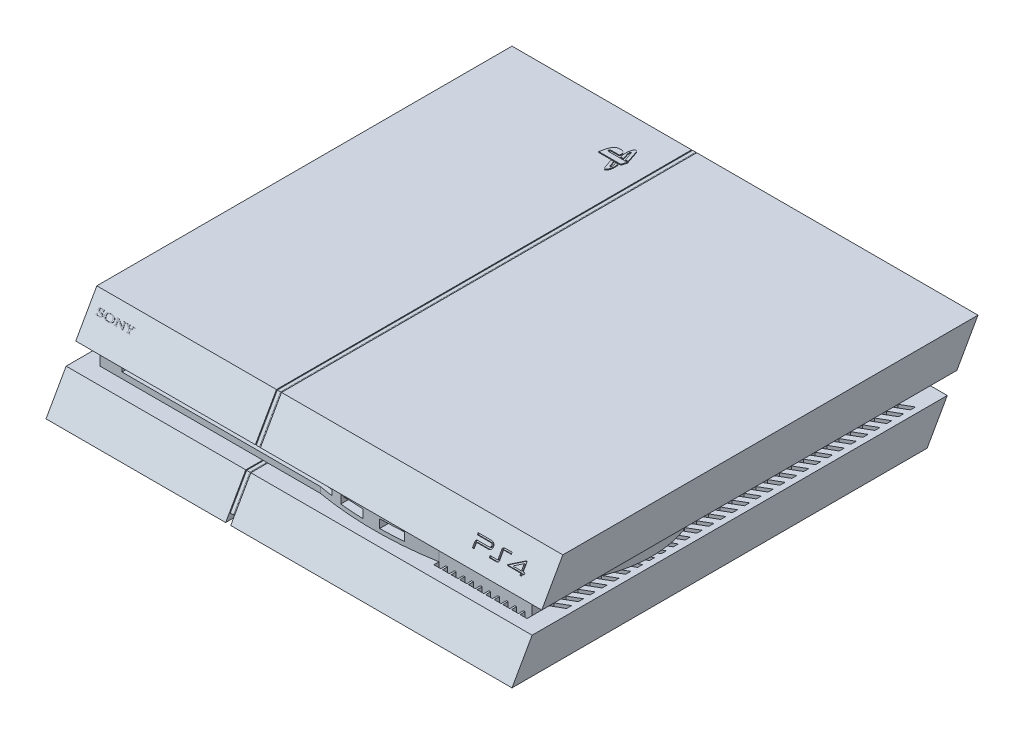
SolidWorks part; units mm, degrees
ref_plane "Front Plane" through (0, 0, 0) normal (0, 0, 1) x (1, 0, 0)
ref_plane "Top Plane" through (0, 0, 0) normal (0, 1, 0) x (1, 0, 0)
ref_plane "Right Plane" through (0, 0, 0) normal (1, 0, 0) x (0, 0, -1)
sketch "Sketch1" plane through (0, 0, 0) normal (0, 1, 0) x (1, 0, 0)
  line L1 (-137.5, 137.5) -> (137.5, 137.5)
  line L2 (-137.5, 137.5) -> (-137.5, -137.5)
  line L3 (-137.5, -137.5) -> (137.5, -137.5)
  line L4 (137.5, 137.5) -> (137.5, -137.5)
  line L5 (-137.5, 137.5) -> (137.5, -137.5) construction
  line L6 (-137.5, -137.5) -> (137.5, 137.5) construction
  point P0 (0, 0)
  dimension "D1" = 275
extrude "Boss-Extrude1" add sketch "Sketch1" along normal mid plane 53
sketch "Sketch2" plane through (137.5, 0, 0) normal (1, 0, 0) x (0, 0, -1)
  line L0 (-137.5, -26.5) -> (-107.5, 26.5)
  line L1 (-137.5, 26.5) -> (137.5, 26.5) construction
  line L2 (-107.5, 26.5) -> (-137.5, 26.5)
  line L3 (-137.5, 26.5) -> (-137.5, -26.5)
  line L4 (137.5, 26.5) -> (107.5, -26.5)
  line L5 (-137.5, -26.5) -> (137.5, -26.5) construction
  line L6 (107.5, -26.5) -> (137.5, -26.5)
  line L7 (137.5, -26.5) -> (137.5, 26.5)
  dimension "D1" = 30
extrude "Cut-Extrude1" cut sketch "Sketch2" against normal through all
sketch "Sketch3" plane through (137.5, 0, 0) normal (1, 0, 0) x (0, 0, -1)
  line L0 (-107.5, 26.5) -> (137.5, 26.5) construction
  line L1 (-119.9528, 4.5) -> (-115.6132, 4.5)
  line L2 (125.0472, 4.5) -> (119.3868, -5.5)
  line L3 (-125.6132, -5.5) -> (-115.6132, -5.5)
  line L4 (-115.6132, 4.5) -> (-115.6132, -5.5)
  line L5 (-137.5, -26.5) -> (-107.5, 26.5) construction
  line L6 (-119.9528, 4.5) -> (-125.6132, -5.5)
  line L7 (137.5, 26.5) -> (107.5, -26.5) construction
  line L8 (119.3868, -5.5) -> (115.0472, -5.5)
  line L9 (115.0472, -5.5) -> (115.0472, 4.5)
  line L10 (115.0472, 4.5) -> (125.0472, 4.5)
  dimension "D1" = 10
  dimension "D2" = 22
  dimension "D3" = 10
extrude "Cut-Extrude2" cut sketch "Sketch3" against normal through all
sketch "Sketch4" plane through (0, 0, 0) normal (0, 0, 1) x (1, 0, 0)
  line L0 (-137.5, -5.5) -> (137.5, -5.5) construction
  line L1 (-137.5, 4.5) -> (-127.5, 4.5)
  line L2 (-137.5, 4.5) -> (-137.5, -5.5)
  line L3 (-137.5, -5.5) -> (-127.5, -5.5)
  line L4 (-127.5, 4.5) -> (-127.5, -5.5)
  line L5 (-137.5, -5.5) -> (137.5, -5.5) construction
  line L6 (137.5, 4.5) -> (127.5, 4.5)
  line L7 (137.5, 4.5) -> (137.5, -5.5)
  line L8 (137.5, -5.5) -> (127.5, -5.5)
  line L9 (127.5, 4.5) -> (127.5, -5.5)
extrude "Cut-Extrude3" cut sketch "Sketch4" against normal mid plane 600
sketch "Sketch5" plane through (0, -5.5, 0) normal (0, 1, 0) x (1, 0, 0)
  line L0 (127.5, 115.0472) -> (127.5, -115.6132) construction
  line L1 (127.5, -74.9528) -> (127.5, -24.9528)
  line L2 (132.5, -49.9528) -> (127.5, -49.9528) construction
  line L3 (-137.5, -119.9528) -> (137.5, -119.9528) construction
  arc A0 (127.5, -24.9528) -> (127.5, -74.9528) centre (67.5, -49.9528) cw
  dimension "D1" = 50
  dimension "D2" = 70
  dimension "D3" = 5
extrude "Boss-Extrude2" add sketch "Sketch5" along normal up to vertex (10 mm away)
fillet "Fillet1" radius 10 2 edges at (127.5, -0.5, 24.9528) (127.5, -0.5, 74.9528)
sketch "Sketch17" plane through (0, -5.5, 0) normal (0, 1, 0) x (1, 0, 0)
  line L0 (-127.5, -115.6132) -> (127.5, -115.6132) construction
  line L1 (2.5, -115.6132) -> (72.5, -115.6132)
  line L2 (37.5, -118.6132) -> (37.5, -115.6132) construction
  line L3 (137.5, -125.6132) -> (137.5, 119.3868) construction
  arc A0 (2.5, -115.6132) -> (72.5, -115.6132) centre (37.5, 87.0535) ccw
  dimension "D1" = 70
  dimension "D2" = 3
  dimension "D3" = 100
extrude "Boss-Extrude9" add sketch "Sketch17" along normal up to vertex (10 mm away)
sketch "Sketch6" plane through (0, 0, 115.6132) normal (0, 0, 1) x (1, 0, 0)
  line L0 (137.5, 4.5) -> (137.5, 26.5) construction
  line L1 (16.5, 2) -> (30.5, 2)
  line L2 (16.5, 2) -> (16.5, -3)
  line L3 (16.5, -3) -> (30.5, -3)
  line L4 (30.5, 2) -> (30.5, -3)
  line L5 (40.5, 2) -> (54.5, 2)
  line L6 (40.5, 2) -> (40.5, -3)
  line L7 (40.5, -3) -> (54.5, -3)
  line L8 (54.5, 2) -> (54.5, -3)
  line L9 (54.5, -0.5) -> (127.5, -0.5) construction
  line L10 (127.5, -5.5) -> (127.5, 4.5) construction
  dimension "D1" = 14
  dimension "D2" = 5
  dimension "D3" = 83
  dimension "D4" = 10
extrude "Cut-Extrude4" cut sketch "Sketch6" against normal blind 25 and the other way blind 20.5
sketch "Sketch7" plane through (0, 0, 115.6132) normal (0, 0, 1) x (1, 0, 0)
  line L0 (10.5, -0.5) -> (16.5, -0.5) construction
  line L1 (-114.5, -2) -> (10.5, -2)
  line L2 (-114.5, -2) -> (-114.5, 1)
  line L3 (-114.5, 1) -> (10.5, 1)
  line L4 (10.5, -2) -> (10.5, 1)
  line L5 (16.5, 2) -> (16.5, -3) construction
  line L6 (-137.5, 4.5) -> (-137.5, 26.5) construction
  dimension "D1" = 3
  dimension "D2" = 125
  dimension "D3" = 23
extrude "Cut-Extrude5" cut sketch "Sketch7" against normal blind 150 and the other way blind 10.5
sketch "Sketch8" plane through (0, 0, 0) normal (0, 0, 1) x (1, 0, 0)
  line L0 (-137.5, 26.5) -> (137.5, 26.5) construction
  line L1 (-31.5, 26.5) -> (-28.5, 26.5)
  line L2 (-31.5, 26.5) -> (-31.5, 4.5)
  line L3 (-31.5, 4.5) -> (-28.5, 4.5)
  line L4 (-28.5, 26.5) -> (-28.5, 4.5)
  line L5 (-137.5, 4.5) -> (-137.5, 26.5) construction
  line L6 (-137.5, 4.5) -> (137.5, 4.5) construction
  line L7 (-127.5, -5.5) -> (2.5, -5.5) construction
  line L8 (-31.5, -5.5) -> (-28.5, -5.5)
  line L9 (-31.5, -5.5) -> (-31.5, -26.5)
  line L10 (-31.5, -26.5) -> (-28.5, -26.5)
  line L11 (-28.5, -5.5) -> (-28.5, -26.5)
  line L12 (-137.5, -26.5) -> (137.5, -26.5) construction
  dimension "D1" = 106
  dimension "D2" = 3
extrude "Cut-Extrude6" cut sketch "Sketch8" against normal mid plane 374
sketch "Sketch9" plane through (-31.5, 0, 0) normal (1, 0, 0) x (0, 0, -1)
  line L6 (137.5, 26.5) -> (-107.5, 26.5)
  line L7 (-107.5, 26.5) -> (-119.9528, 4.5)
  line L8 (-119.9528, 4.5) -> (-115.6132, 4.5)
  line L9 (-115.6132, 4.5) -> (115.0472, 4.5)
  line L10 (115.0472, 4.5) -> (125.0472, 4.5)
  line L11 (125.0472, 4.5) -> (137.5, 26.5)
  line L12 (137.5, 26.5) -> (-107.5, 26.5)
  line L13 (-107.5, 26.5) -> (-119.9528, 4.5)
  line L14 (-119.9528, 4.5) -> (-115.6132, 4.5)
  line L15 (-115.6132, 4.5) -> (115.0472, 4.5)
  line L16 (115.0472, 4.5) -> (125.0472, 4.5)
  line L17 (125.0472, 4.5) -> (137.5, 26.5)
  dimension "D1" = 0
extrude "Cut-Extrude7" cut sketch "Sketch9" against normal blind 250
sketch "Sketch10" plane through (-137.5, 0, 0) normal (-1, 0, 0) x (0, 0, 1)
  line L6 (-125.0472, 4.5) -> (-115.0472, 4.5)
  line L7 (-115.0472, 4.5) -> (115.6132, 4.5)
  line L8 (115.6132, 4.5) -> (119.9528, 4.5)
  line L9 (119.9528, 4.5) -> (107.5, 26.5)
  line L10 (107.5, 26.5) -> (-137.5, 26.5)
  line L11 (-137.5, 26.5) -> (-125.0472, 4.5)
  line L12 (-125.0472, 4.5) -> (-115.0472, 4.5)
  line L13 (-115.0472, 4.5) -> (115.6132, 4.5)
  line L14 (115.6132, 4.5) -> (119.9528, 4.5)
  line L15 (119.9528, 4.5) -> (107.5, 26.5)
  line L16 (107.5, 26.5) -> (-137.5, 26.5)
  line L17 (-137.5, 26.5) -> (-125.0472, 4.5)
  dimension "D1" = 0
extrude "Boss-Extrude3" add sketch "Sketch10" against normal blind 106 separate body
ref_plane "Plane1" through (-30, 0, 0) normal (1, 0, 0) x (0, 0, -1)
sketch "Sketch11" plane through (-30, 0, 0) normal (1, 0, 0) x (0, 0, -1)
  line L0 (-135.2358, -22.5) -> (-134.0868, -22.5)
  line L1 (-134.0868, -22.5) -> (-125.0302, -6.5)
  line L2 (-125.0302, -6.5) -> (117.6717, -6.5)
  line L3 (117.6717, -6.5) -> (106.3509, -26.5)
  line L4 (125.0472, 4.5) -> (137.5, 26.5)
  line L5 (137.5, 26.5) -> (-107.5, 26.5)
  line L6 (-107.5, 26.5) -> (-119.9528, 4.5)
  line L7 (-119.9528, 4.5) -> (125.0472, 4.5)
  line L8 (125.0472, 4.5) -> (137.5, 26.5)
  line L9 (137.5, 26.5) -> (-107.5, 26.5)
  line L10 (-107.5, 26.5) -> (-119.9528, 4.5)
  line L11 (123.8981, 4.5) -> (135.7849, 25.5)
  line L12 (135.7849, 25.5) -> (-106.917, 25.5)
  line L13 (-106.917, 25.5) -> (-118.8037, 4.5)
  line L14 (-137.5, -26.5) -> (107.5, -26.5)
  line L15 (107.5, -26.5) -> (119.3868, -5.5)
  line L16 (119.3868, -5.5) -> (115.0472, -5.5)
  line L17 (115.0472, -5.5) -> (-115.6132, -5.5)
  line L18 (-115.6132, -5.5) -> (-125.6132, -5.5)
  line L19 (-125.6132, -5.5) -> (-137.5, -26.5)
  line L20 (106.3509, -26.5) -> (107.5, -26.5)
  line L21 (107.5, -26.5) -> (119.3868, -5.5)
  line L22 (119.3868, -5.5) -> (115.0472, -5.5)
  line L23 (115.0472, -5.5) -> (-115.6132, -5.5)
  line L24 (-115.6132, -5.5) -> (-125.6132, -5.5)
  line L25 (-125.6132, -5.5) -> (-135.2358, -22.5)
  line L26 (-119.9528, 4.5) -> (-118.8037, 4.5)
  line L27 (125.0472, 4.5) -> (-119.9528, 4.5) construction
  line L28 (-106.917, 25.5) -> (-119.0826, 4.0074) construction
  line L29 (125.0472, 4.5) -> (123.8981, 4.5)
  line L30 (124.1769, 4.9926) -> (135.7849, 25.5) construction
  dimension "D3" = 4
  dimension "D4" = 1
  dimension "D5" = 1
  dimension "D6" = 1
  dimension "D1" = 0
  dimension "D2" = 0
  dimension "D7" = 1
extrude "Boss-Extrude4" add sketch "Sketch11" along normal mid plane 2.8 separate body
fillet "Fillet2" radius 0.5 4 edges at (-31.4, 26.5, -15) (-28.6, 26.5, -15) (-28.6, 15.5, 113.7264) (-31.4, 15.5, 113.7264)
fillet "Fillet3" radius 0.5 4 edges at (-28.6, -5.5, 3.1132) (-31.4, -5.5, 3.1132) (-28.6, -14, 130.4245) (-31.4, -14, 130.4245)
sketch "Sketch12" plane through (0, 52.5142, 92.775) normal (0, 0.4926, 0.8703) x (1, 0, 0)
  line L0 (-132.8546, -40.9113) -> (-97.413, -40.9113) construction
  text T0 "SONY" font "Constantia" height 3.5
extrude "Boss-Extrude5" add sketch "Sketch12" along normal blind 0.1 separate body
sketch "Sketch13" plane through (0, 52.5142, 92.775) normal (0, 0.4926, 0.8703) x (1, 0, 0)
  line L0 (92.5, -39.8925) -> (100.5, -39.8925)
  line L1 (100.5, -43.8925) -> (93.7, -43.8925)
  line L2 (93.5, -44.0925) -> (93.5, -46.8925)
  line L3 (93.5, -46.8925) -> (92.5, -46.8925)
  line L4 (92.5, -46.8925) -> (92.5, -44.0925)
  line L5 (93.7, -42.8925) -> (100.5, -42.8925)
  line L6 (100.5, -40.8925) -> (92.5, -40.8925)
  line L7 (92.5, -40.8925) -> (92.5, -39.8925)
  line L8 (112.5, -39.8925) -> (108.2, -39.8925)
  line L9 (107, -41.0925) -> (107, -45.6925)
  line L10 (106.8, -45.8925) -> (102.5, -45.8925)
  line L11 (102.5, -45.8925) -> (102.5, -46.8925)
  line L12 (102.5, -46.8925) -> (106.8, -46.8925)
  line L13 (108, -45.6925) -> (108, -41.0925)
  line L14 (108.2, -40.8925) -> (112.5, -40.8925)
  line L15 (112.5, -40.8925) -> (112.5, -39.8925)
  line L16 (121.1909, -39.9249) -> (112.5909, -45.5249)
  line L17 (112.7, -45.8925) -> (120.5, -45.8925)
  line L18 (120.5, -45.8925) -> (120.5, -46.8925)
  line L19 (120.5, -46.8925) -> (121.5, -46.8925)
  line L20 (121.5, -46.8925) -> (121.5, -45.8925)
  line L21 (121.5, -45.8925) -> (122.5, -45.8925)
  line L22 (122.5, -45.8925) -> (122.5, -44.8925)
  line L23 (122.5, -44.8925) -> (121.5, -44.8925)
  line L24 (121.5, -44.8925) -> (121.5, -40.0925)
  line L25 (120.5, -41.5681) -> (115.3947, -44.8925)
  line L26 (115.3947, -44.8925) -> (120.5, -44.8925)
  line L27 (120.5, -44.8925) -> (120.5, -41.5681)
  line L28 (101.1247, -39.8925) -> (135.9586, -39.8925) construction
  line L29 (95.2462, -46.8925) -> (136.634, -46.8925) construction
  line L30 (-28.5, -29.8925) -> (137.5, -29.8925) construction
  line L31 (102.5, -39.8925) -> (102.5, -46.8925) construction
  line L32 (137.5, -55.1724) -> (137.5, -29.8925) construction
  line L33 (116.8909, -42.7249) -> (117.4365, -43.5629) construction
  line L35 (112.5, -39.8925) -> (112.5, -46.8925) construction
  line L36 (120.5, -43.2303) -> (121.5, -43.2303) construction
  line L38 (117.9473, -44.8925) -> (117.9473, -45.8925) construction
  arc A0 (100.5, -39.8925) -> (100.5, -43.8925) centre (100.5, -41.8925) cw
  arc A1 (100.5, -42.8925) -> (100.5, -40.8925) centre (100.5, -41.8925) ccw
  arc A2 (93.7, -42.8925) -> (92.5, -44.0925) centre (93.7, -44.0925) ccw
  arc A3 (93.7, -43.8925) -> (93.5, -44.0925) centre (93.7, -44.0925) ccw
  arc A4 (108.2, -39.8925) -> (107, -41.0925) centre (108.2, -41.0925) ccw
  arc A5 (107, -45.6925) -> (106.8, -45.8925) centre (106.8, -45.6925) cw
  arc A6 (106.8, -46.8925) -> (108, -45.6925) centre (106.8, -45.6925) ccw
  arc A7 (108, -41.0925) -> (108.2, -40.8925) centre (108.2, -41.0925) cw
  arc A8 (112.5909, -45.5249) -> (112.7, -45.8925) centre (112.7, -45.6925) ccw
  arc A9 (121.5, -40.0925) -> (121.1909, -39.9249) centre (121.3, -40.0925) ccw
  dimension "D5" = 0.2
  dimension "D1" = 7
  dimension "D2" = 10
  dimension "D3" = 1
  dimension "D4" = 10
  dimension "D6" = 45
  dimension "D7" = 2
  dimension "D8" = 10
  dimension "D9" = 1
  dimension "D10" = 10
extrude "Cut-Extrude8" cut sketch "Sketch13" against normal blind 1
sketch "Sketch15" plane through (0, 0, 90.6132) normal (0, 0, 1) x (1, 0, 0)
  line L8 (30.5, -3) -> (30.5, 2) construction
  line L9 (16.5, 2) -> (30.5, 2)
  line L10 (16.5, 2) -> (16.5, -0.5)
  line L11 (16.5, -0.5) -> (30.5, -0.5)
  line L12 (30.5, 2) -> (30.5, -0.5)
  line L13 (40.5, 2) -> (40.5, -3) construction
  line L14 (54.5, 2) -> (40.5, 2)
  line L15 (54.5, 2) -> (54.5, -0.5)
  line L16 (54.5, -0.5) -> (40.5, -0.5)
  line L17 (40.5, 2) -> (40.5, -0.5)
extrude "Boss-Extrude7" add sketch "Sketch15" along normal blind 25 separate body
sketch "Sketch16" plane through (0, 26.5, 0) normal (0, 1, 0) x (1, 0, 0)
  line L1 (-44.5061, 108.7098) -> (-57.5493, 108.7098)
  line L2 (-57.5493, 108.7098) -> (-56.769, 111.9692)
  line L3 (-49.7782, 113.0054) -> (-54.522, 113.0054)
  line L4 (-54.579, 111.66) -> (-43.6022, 111.66)
  line L6 (-43.6022, 111.66) -> (-44.5061, 108.7098)
  line L7 (-45.3923, 112.3689) -> (-43.7929, 112.3689)
  line L8 (-43.7929, 112.3689) -> (-46.1463, 119.2846)
  line L9 (-48.271, 112.3689) -> (-46.6169, 112.3689)
  line L10 (-46.6169, 112.3689) -> (-47.7166, 115.6002)
  line L11 (-47.0897, 117.2398) -> (-45.3923, 112.3689)
  line L12 (-49.5454, 108.0325) -> (-47.9712, 108.0325)
  line L13 (-47.9712, 108.0325) -> (-47.0897, 105.3705)
  line L14 (-49.5454, 108.0325) -> (-49.5454, 107.8022)
  line L15 (-49.5454, 107.8022) -> (-47.6117, 102.464)
  line L16 (-46.7834, 107.8022) -> (-46.7834, 107.9972)
  line L17 (-46.7834, 107.9972) -> (-45.3482, 107.9972)
  arc A0 (-56.769, 111.9692) -> (-55.2849, 115.2302) centre (-47.6437, 109.7844) cw
  arc A1 (-55.2849, 115.2302) -> (-53.9356, 116.114) centre (-53.4765, 113.9413) cw
  arc A2 (-53.9356, 116.114) -> (-52.0658, 116.3094) centre (-52.0658, 107.2657) cw
  arc A3 (-52.0658, 116.3094) -> (-50.3751, 115.9057) centre (-52.0658, 112.5675) cw
  arc A4 (-50.3751, 115.9057) -> (-49.4566, 114.2391) centre (-51.1384, 114.3986) cw
  arc A5 (-49.4566, 114.2391) -> (-49.7782, 113.0054) centre (-53.4293, 114.6159) cw
  arc A6 (-54.522, 113.0054) -> (-55.2849, 112.4792) centre (-54.522, 112.1893) ccw
  arc A7 (-55.2849, 112.4792) -> (-54.9473, 111.7276) centre (-54.7403, 112.2722) ccw
  arc A8 (-54.9473, 111.7276) -> (-54.579, 111.66) centre (-54.579, 112.6966) ccw
  arc A9 (-46.1463, 119.2846) -> (-46.8687, 120.3135) centre (-48.2695, 118.562) ccw
  arc A10 (-46.8687, 120.3135) -> (-47.8528, 120.1005) centre (-47.2741, 119.8066) ccw
  arc A11 (-47.8528, 120.1005) -> (-47.8977, 120.0113) centre (-33.8838, 113.0054) ccw
  arc A12 (-47.8977, 120.0113) -> (-48.8256, 115.8354) centre (-40.0086, 116.0673) ccw
  arc A13 (-48.8256, 115.8354) -> (-48.271, 112.3689) centre (-35.5294, 116.1852) ccw
  arc A14 (-47.7166, 115.6002) -> (-47.8977, 117.3237) centre (-44.0121, 116.8609) cw
  arc A15 (-47.8977, 117.3237) -> (-47.6437, 117.7877) centre (-47.1936, 117.2398) cw
  arc A16 (-47.6437, 117.7877) -> (-47.3114, 117.7318) centre (-47.5019, 117.6151) cw
  arc A17 (-47.3114, 117.7318) -> (-47.0897, 117.2398) centre (-49.1373, 116.6129) cw
  arc A18 (-47.6117, 102.464) -> (-46.8831, 101.6326) centre (-46.1824, 102.9817) ccw
  arc A19 (-46.8831, 101.6326) -> (-46.5639, 101.6491) centre (-46.7376, 101.9128) ccw
  arc A20 (-46.5639, 101.6491) -> (-45.8219, 102.5233) centre (-47.6869, 103.3544) ccw
  arc A21 (-47.0897, 105.3705) -> (-46.713, 104.4502) centre (-40.2079, 107.6496) ccw
  arc A22 (-46.713, 104.4502) -> (-46.1832, 104.4881) centre (-46.4558, 104.5767) ccw
  arc A23 (-46.1832, 104.4881) -> (-46.0695, 105.6575) centre (-48.7756, 105.3304) ccw
  arc A24 (-46.7834, 107.8022) -> (-46.0695, 105.6575) centre (-51.6897, 104.9781) cw
  arc A25 (-45.3482, 107.9972) -> (-45.1923, 104.9659) centre (-56.286, 105.9149) cw
  arc A26 (-45.1923, 104.9659) -> (-45.8219, 102.5233) centre (-52.7553, 105.6129) cw
extrude "Boss-Extrude8" add sketch "Sketch16" along normal blind 0.5 separate body
sketch "Sketch18" plane through (0, -5.5, 0) normal (0, 1, 0) x (1, 0, 0)
  line L0 (72.5, -115.6132) -> (127.5, -115.6132) construction
  line L1 (72.5, -115.6132) -> (76.5909, -115.6132)
  line L2 (72.5, -115.6132) -> (72.5, -118.6132)
  line L3 (72.5, -118.6132) -> (76.5909, -118.6132)
  line L4 (76.5909, -115.6132) -> (76.5909, -118.6132)
  line L5 (77.5909, -115.6132) -> (81.6818, -115.6132)
  line L6 (77.5909, -115.6132) -> (77.5909, -118.6132)
  line L7 (77.5909, -118.6132) -> (81.6818, -118.6132)
  line L8 (81.6818, -115.6132) -> (81.6818, -118.6132)
  line L9 (76.5909, -117.1132) -> (77.5909, -117.1132) construction
  line L10 (82.6818, -115.6132) -> (86.7727, -115.6132)
  line L11 (82.6818, -115.6132) -> (82.6818, -118.6132)
  line L12 (82.6818, -118.6132) -> (86.7727, -118.6132)
  line L13 (86.7727, -115.6132) -> (86.7727, -118.6132)
  line L14 (87.7727, -115.6132) -> (91.8636, -115.6132)
  line L15 (87.7727, -115.6132) -> (87.7727, -118.6132)
  line L16 (87.7727, -118.6132) -> (91.8636, -118.6132)
  line L17 (91.8636, -115.6132) -> (91.8636, -118.6132)
  line L18 (92.8636, -115.6132) -> (96.9545, -115.6132)
  line L19 (92.8636, -115.6132) -> (92.8636, -118.6132)
  line L20 (92.8636, -118.6132) -> (96.9545, -118.6132)
  line L21 (96.9545, -115.6132) -> (96.9545, -118.6132)
  line L22 (97.9545, -115.6132) -> (102.0455, -115.6132)
  line L23 (97.9545, -115.6132) -> (97.9545, -118.6132)
  line L24 (97.9545, -118.6132) -> (102.0455, -118.6132)
  line L25 (102.0455, -115.6132) -> (102.0455, -118.6132)
  line L26 (103.0455, -115.6132) -> (107.1364, -115.6132)
  line L27 (103.0455, -115.6132) -> (103.0455, -118.6132)
  line L28 (103.0455, -118.6132) -> (107.1364, -118.6132)
  line L29 (107.1364, -115.6132) -> (107.1364, -118.6132)
  line L30 (108.1364, -115.6132) -> (112.2273, -115.6132)
  line L31 (108.1364, -115.6132) -> (108.1364, -118.6132)
  line L32 (108.1364, -118.6132) -> (112.2273, -118.6132)
  line L33 (112.2273, -115.6132) -> (112.2273, -118.6132)
  line L34 (113.2273, -115.6132) -> (117.3182, -115.6132)
  line L35 (113.2273, -115.6132) -> (113.2273, -118.6132)
  line L36 (113.2273, -118.6132) -> (117.3182, -118.6132)
  line L37 (117.3182, -115.6132) -> (117.3182, -118.6132)
  line L38 (118.3182, -115.6132) -> (122.4091, -115.6132)
  line L39 (118.3182, -115.6132) -> (118.3182, -118.6132)
  line L40 (118.3182, -118.6132) -> (122.4091, -118.6132)
  line L41 (122.4091, -115.6132) -> (122.4091, -118.6132)
  line L42 (123.4091, -115.6132) -> (127.5, -115.6132)
  line L43 (123.4091, -115.6132) -> (123.4091, -118.6132)
  line L44 (123.4091, -118.6132) -> (127.5, -118.6132)
  line L45 (127.5, -115.6132) -> (127.5, -118.6132)
  line L47 (81.6818, -117.1132) -> (82.6818, -117.1132) construction
  line L49 (86.7727, -117.1132) -> (87.7727, -117.1132) construction
  line L51 (91.8636, -117.1132) -> (92.8636, -117.1132) construction
  line L53 (96.9545, -117.1132) -> (97.9545, -117.1132) construction
  line L55 (102.0455, -117.1132) -> (103.0455, -117.1132) construction
  line L57 (107.1364, -117.1132) -> (108.1364, -117.1132) construction
  line L59 (112.2273, -117.1132) -> (113.2273, -117.1132) construction
  line L61 (117.3182, -117.1132) -> (118.3182, -117.1132) construction
  line L63 (122.4091, -117.1132) -> (123.4091, -117.1132) construction
  dimension "D1" = 1
  dimension "D2" = 3
extrude "Cut-Extrude9" cut sketch "Sketch18" against normal blind 10.5
sketch "Sketch19" plane through (0, -5.5, 0) normal (0, 1, 0) x (1, 0, 0)
  line L0 (127.5, -102.6132) -> (134, -98.8604)
  line L1 (127.5, -76.8787) -> (127.5, -115.6132) construction
  line L2 (134, -98.8604) -> (134, -101.8604)
  line L3 (134, -101.8604) -> (127.5, -105.6132)
  line L4 (127.5, -105.6132) -> (127.5, -102.6132)
  line L5 (127.5, -115.6132) -> (123.4091, -115.6132) construction
  dimension "D1" = 6.5
  dimension "D2" = 60
  dimension "D3" = 3
  dimension "D4" = 10
extrude "Cut-Extrude10" cut sketch "Sketch19" against normal blind 10.5
pattern_linear "LPattern1" count 30 spacing 7 along (0, 0, -1) of "Cut-Extrude10"
mirror "Mirror1" about plane through (0, 0, 0) normal (1, 0, 0) of "LPattern1", "Cut-Extrude10"
ref_plane "Plane2" through (135.5, 0, 0) normal (1, 0, 0) x (0, 0, -1)
sketch "Sketch20" plane through (135.5, 0, 0) normal (1, 0, 0) x (0, 0, -1)
  line L0 (-137.5, -26.5) -> (107.5, -26.5) construction
  line L1 (-25, -26.5) -> (25, -26.5)
  line L2 (0, -28) -> (0, -26.5) construction
  line L3 (0, -26.5) -> (0, 0) construction
  arc A0 (-25, -26.5) -> (25, -26.5) centre (0, 181.0833) ccw
  dimension "D1" = 50
  dimension "D2" = 1.5
extrude "Boss-Extrude10" add sketch "Sketch20" against normal blind 2 separate body
sketch "Sketch21" plane through (-30, 0, 0) normal (1, 0, 0) x (0, 0, -1)
  line L1 (-106.917, 25.5) -> (43.083, 25.5)
  line L2 (-106.917, 25.5) -> (-106.917, 23.5)
  line L3 (-106.917, 23.5) -> (43.083, 23.5)
  line L4 (43.083, 25.5) -> (43.083, 23.5)
  dimension "D1" = 150
  dimension "D2" = 2
extrude "Boss-Extrude11" add sketch "Sketch21" along normal mid plane 2.5 separate body
sketch "Sketch22" plane through (0, 0, -115.0472) normal (0, 0, -1) x (-1, 0, 0)
  line L0 (-117.5, 0.5) -> (-117.5, -1.5) construction
  line L1 (-124.5, 3.5) -> (-110.5, 3.5)
  line L2 (-124.5, 3.5) -> (-124.5, 0.5)
  line L3 (-124.5, 0.5) -> (-110.5, 0.5)
  line L4 (-110.5, 3.5) -> (-110.5, 0.5)
  line L5 (-124.5, -1.5) -> (-110.5, -1.5)
  line L6 (-124.5, -1.5) -> (-124.5, -4.5)
  line L7 (-124.5, -4.5) -> (-110.5, -4.5)
  line L8 (-110.5, -1.5) -> (-110.5, -4.5)
  line L10 (-127.5, 4.5) -> (-127.5, -5.5) construction
  line L11 (-127.5, -0.5) -> (-117.5, -0.5) construction
  dimension "D1" = 3
  dimension "D2" = 14
  dimension "D3" = 10
  dimension "D4" = 2
extrude "Cut-Extrude11" cut sketch "Sketch22" against normal blind 10
pattern_linear "LPattern2" count 16 spacing 15.5 along (-1, 0, 0) of "Cut-Extrude11"
